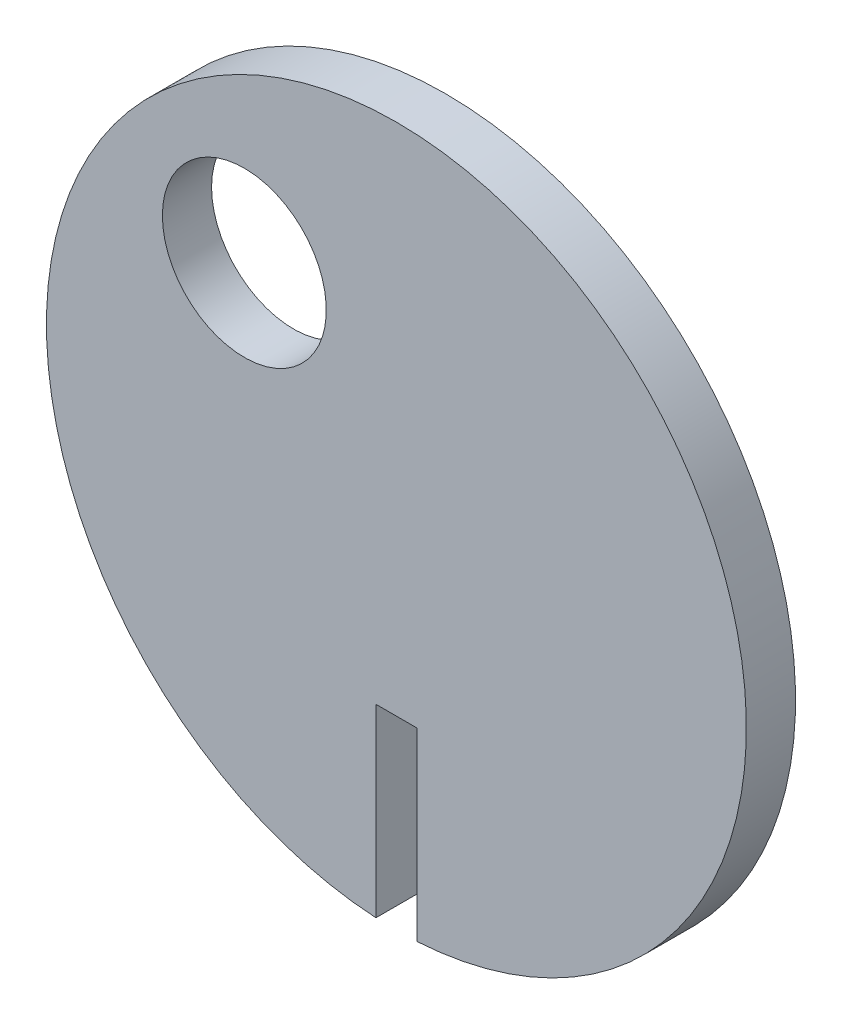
SolidWorks part; units mm, degrees
ref_plane "Front Plane" through (0, 0, 0) normal (0, 0, 1) x (1, 0, 0)
ref_plane "Top Plane" through (0, 0, 0) normal (0, 1, 0) x (1, 0, 0)
ref_plane "Right Plane" through (0, 0, 0) normal (1, 0, 0) x (0, 0, -1)
sketch "Sketch1" plane through (0, 0, 0) normal (0, 0, 1) x (1, 0, 0)
  circle A0 centre (0, 0) radius 27.1145
  dimension "D1" = 54.229
extrude "Extrude1" add sketch "Sketch1" along normal blind 3.81
sketch "Sketch2" plane through (0, 0, 0) normal (0, 0, 1) x (1, 0, 0)
  line L0 (0, 27.1145) -> (0, -27.1145) construction
  line L4 (-1.5875, -12.7431) -> (1.5875, -12.7431)
  line L5 (-1.5875, -12.7431) -> (-1.5875, -29.8403)
  line L6 (1.5875, -12.7431) -> (1.5875, -29.8403)
  line L7 (1.5875, -29.8403) -> (-1.5875, -29.8403)
  circle A0 centre (0, 0) radius 27.1145 construction
  circle A1 centre (-11.7821, 11.7821) radius 6.35
  dimension "D3" = 12.7
  dimension "D4" = 3.175
  dimension "D5" = 1.5875
extrude "Cut-Extrude1" cut sketch "Sketch2" along normal through all
